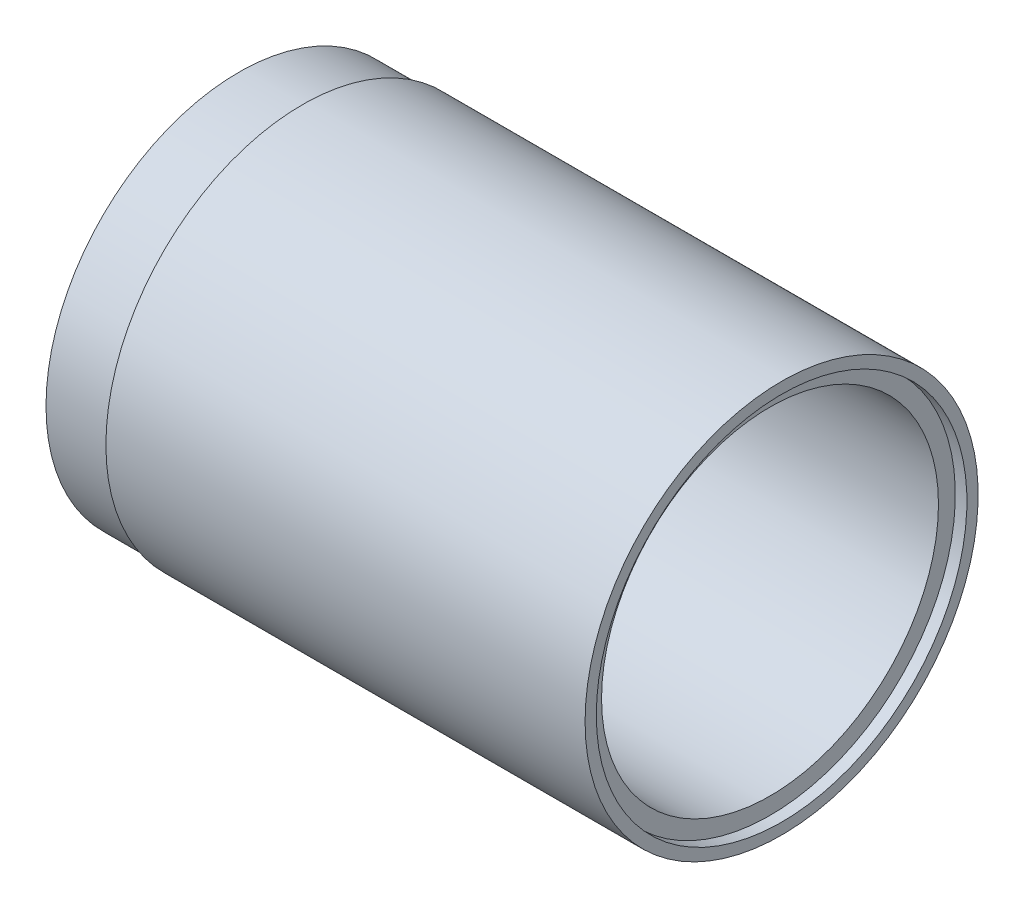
SolidWorks part; units mm, degrees
ref_plane "Plan de face" through (0, 0, 0) normal (0, 0, 1) x (1, 0, 0)
ref_plane "Plan de dessus" through (0, 0, 0) normal (0, 1, 0) x (1, 0, 0)
ref_plane "Plan de droite" through (0, 0, 0) normal (1, 0, 0) x (0, 0, -1)
sketch "Esquisse1" plane through (0, 0, 0) normal (0, 0, 1) x (1, 0, 0)
  line L0 (0, 0) -> (174.1304, 0) construction
  line L1 (0, 51.5) -> (17, 51.5)
  line L2 (17, 51.5) -> (17, 52.5)
  line L3 (17, 52.5) -> (145, 52.5)
  line L4 (145, 52.5) -> (145, 49.5)
  line L5 (145, 49.5) -> (141.9, 49.5)
  line L6 (141.9, 49.5) -> (141.9, 45)
  line L7 (141.9, 45) -> (0, 45)
  line L8 (0, 45) -> (0, 51.5)
  dimension "D1" = 45
  dimension "D2" = 51.5
  dimension "D3" = 99
  dimension "D4" = 105
  dimension "D5" = 3.1
  dimension "D6" = 145
  dimension "D7" = 17
revolve "Révolution1" add sketch "Esquisse1" angle 360 about L0
